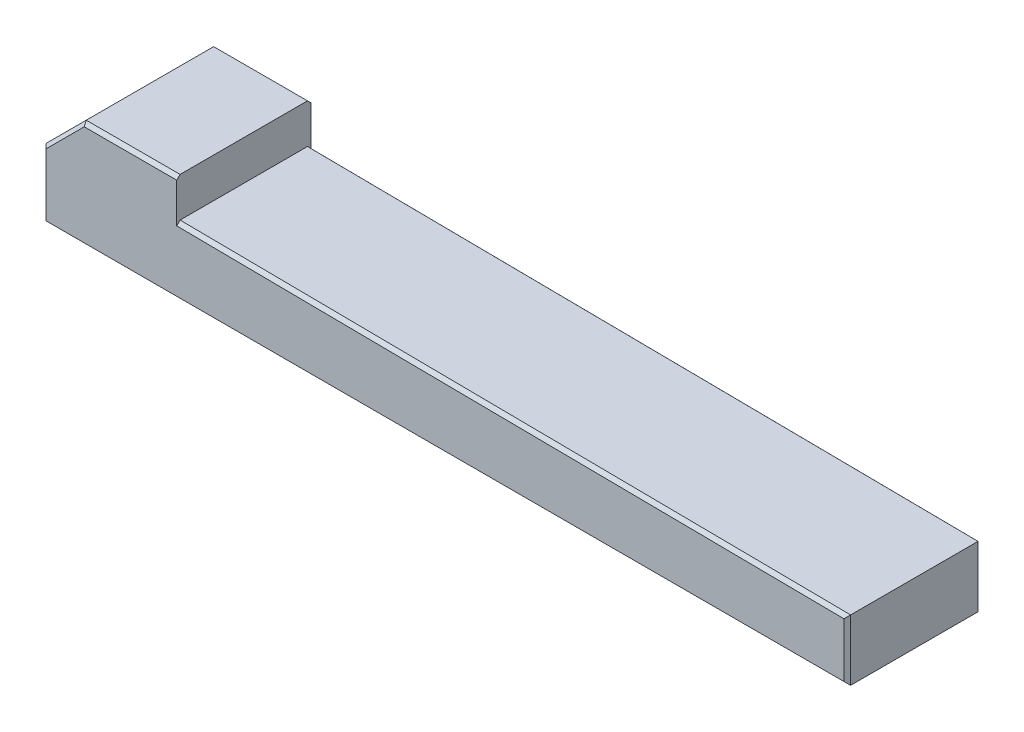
SolidWorks part; units mm, degrees
ref_plane "Front" through (0, 0, 0) normal (0, 0, 1) x (1, 0, 0)
ref_plane "Top" through (0, 0, 0) normal (0, 1, 0) x (1, 0, 0)
ref_plane "Right" through (0, 0, 0) normal (1, 0, 0) x (0, 0, -1)
sketch "Sketch1" plane through (0, 0, 0) normal (0, 0, 1) x (1, 0, 0)
  line L0 (0, 0) -> (600, 0)
  line L1 (600, 0) -> (600, 45.4995)
  line L2 (600, 45.4995) -> (100, 50.5001)
  line L3 (100, 50.5001) -> (100, 80)
  line L4 (100, 80) -> (30, 80)
  line L5 (30, 80) -> (0, 50)
  line L6 (0, 50) -> (0, 0)
  point P8 (150, 50)
  dimension "b" = 100
  dimension "Angle" = 45
  dimension "L" = 500
  dimension "h" = 50
  dimension "h1" = 80
  dimension "D6" = 50
  dimension "D7" = 50
  dimension "D8" = 0.573
extrude "BaseKey" add sketch "Sketch1" along normal mid plane 100
chamfer "Chamfer1" distance 2.5 angle 45 12 edges at (65, 80, -50) (15, 65, -50) (0, 25, -50) (300, 0, -50) (600, 22.7498, -50) (350, 47.9998, -50) (0, 25, 50) (15, 65, 50) (65, 80, 50) (300, 0, 50) (600, 22.7498, 50) (350, 47.9998, 50)
equation "\"D7@Sketch1\" = \"h@Sketch1\""
equation "\"D6@Sketch1\" = \"h@Sketch1\""
equation "\"D1@BaseKey\" = \"b@Sketch1\""
